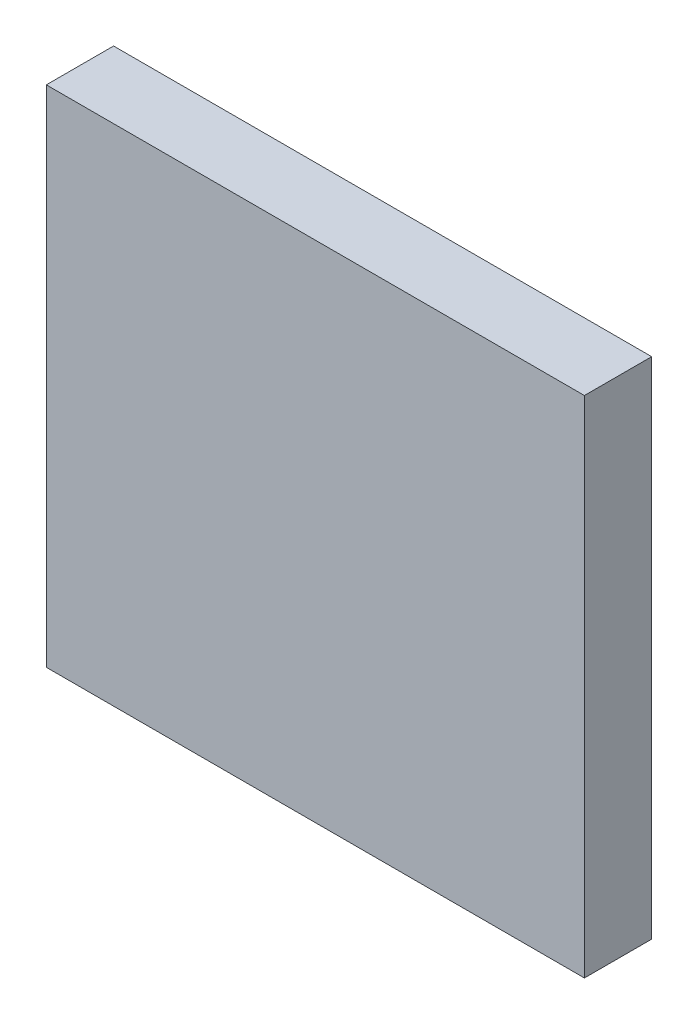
SolidWorks part; units mm, degrees
ref_plane "Front Plane" through (0, 0, 0) normal (0, 0, 1) x (1, 0, 0)
ref_plane "Top Plane" through (0, 0, 0) normal (0, 1, 0) x (1, 0, 0)
ref_plane "Right Plane" through (0, 0, 0) normal (1, 0, 0) x (0, 0, -1)
sketch "Sketch1" plane through (0, 0, 0) normal (0, 0, 1) x (1, 0, 0)
  line L1 (0, 0) -> (50.8, 0)
  line L2 (0, 0) -> (0, 47.625)
  line L3 (0, 47.625) -> (50.8, 47.625)
  line L4 (50.8, 0) -> (50.8, 47.625)
  dimension "D1" = 50.8
  dimension "D2" = 47.625
extrude "Boss-Extrude1" add sketch "Sketch1" along normal blind 6.35
